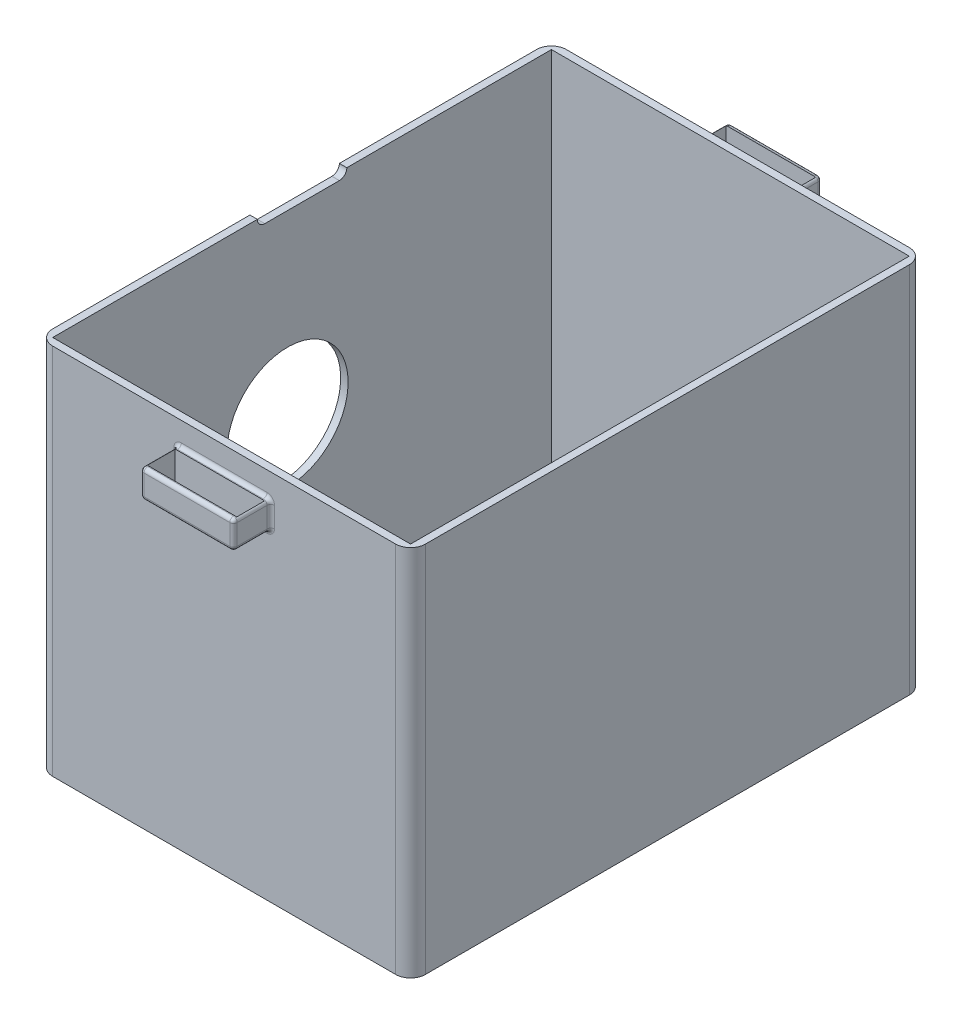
SolidWorks part; units mm, degrees
ref_plane "Front Plane" through (0, 0, 0) normal (0, 0, 1) x (1, 0, 0)
ref_plane "Top Plane" through (0, 0, 0) normal (0, 1, 0) x (1, 0, 0)
ref_plane "Right Plane" through (0, 0, 0) normal (1, 0, 0) x (0, 0, -1)
sketch "Sketch1" plane through (0, 0, 0) normal (0, 1, 0) x (1, 0, 0)
  line L1 (0, 0) -> (254, 0)
  line L2 (0, 0) -> (0, 350.012)
  line L3 (0, 350.012) -> (254, 350.012)
  line L4 (254, 0) -> (254, 350.012)
  dimension "D1" = 254
  dimension "D2" = 350.012
extrude "Boss-Extrude1" add sketch "Sketch1" along normal blind 254
sketch "Sketch10" plane through (0, 254, 0) normal (0, 1, 0) x (1, 0, 0)
  line L0 (254, 350.012) -> (0, 350.012) construction
  line L1 (5.08, 344.932) -> (248.92, 344.932)
  line L2 (5.08, 344.932) -> (5.08, 5.08)
  line L3 (5.08, 5.08) -> (248.92, 5.08)
  line L4 (248.92, 344.932) -> (248.92, 5.08)
  line L5 (0, 0) -> (254, 0) construction
  line L6 (0, 350.012) -> (0, 0) construction
  line L7 (254, 0) -> (254, 350.012) construction
  dimension "D1" = 5.08
  dimension "D2" = 5.08
  dimension "D3" = 5.08
  dimension "D4" = 5.08
extrude "Cut-Extrude13" cut sketch "Sketch10" against normal blind 253.238
sketch "Sketch11" plane through (0, 0, 0) normal (-1, 0, 0) x (0, 0, 1)
  line L0 (-350.012, 0) -> (0, 0) construction
  line L1 (0, 254) -> (0, 0) construction
  circle A0 centre (-165.1, 127) radius 41.275
  dimension "D1" = 82.55
  dimension "D2" = 127
  dimension "D3" = 165.1
extrude "Cut-Extrude14" cut sketch "Sketch11" against normal blind 241.3
fillet "Fillet2" radius 10.16 4 edges at (254, 127, -350.012) (0, 127, -350.012) (0, 127, 0) (254, 127, 0)
sketch "Sketch12" plane through (0, 0, 0) normal (-1, 0, 0) x (0, 0, 1)
  line L0 (-200.406, 254) -> (-149.606, 254) construction
  line L1 (-339.852, 254) -> (-10.16, 254) construction
  line L2 (-200.406, 259.08) -> (-149.606, 259.08)
  line L3 (-200.406, 248.92) -> (-149.606, 248.92)
  arc A0 (-200.406, 259.08) -> (-200.406, 248.92) centre (-200.406, 254) ccw
  arc A1 (-149.606, 248.92) -> (-149.606, 259.08) centre (-149.606, 254) ccw
  point P4 (-175.006, 254)
  dimension "D2" = 5.08
  dimension "D1" = 50.8
extrude "Cut-Extrude15" cut sketch "Sketch12" against normal blind 7.62
sketch "Sketch13" plane through (0, 0.762, 0) normal (0, 1, 0) x (1, 0, 0)
  circle A0 centre (50.8, 299.212) radius 2.54
  circle A1 centre (203.2, 299.212) radius 2.54
  circle A2 centre (203.2, 50.8) radius 2.54
  circle A3 centre (50.8, 50.8) radius 2.54
  arc A6 (243.84, 0) -> (254, 10.16) centre (243.84, 10.16) ccw construction
  arc A7 (254, 339.852) -> (243.84, 350.012) centre (243.84, 339.852) ccw construction
  arc A9 (10.16, 350.012) -> (0, 339.852) centre (10.16, 339.852) ccw construction
  dimension "D1" = 5.08
  dimension "D2" = 5.08
  dimension "D3" = 5.08
  dimension "D4" = 5.08
  dimension "D5" = 40.64
  dimension "D6" = 40.64
  dimension "D7" = 40.64
  dimension "D8" = 40.64
  dimension "D9" = 40.64
  dimension "D10" = 40.64
  dimension "D11" = 50.8
extrude "Cut-Extrude16" cut sketch "Sketch13" against normal through all
sketch "Sketch15" plane through (0, 0, 0) normal (0, 0, 1) x (1, 0, 0)
  line L0 (243.84, 0) -> (243.84, 254) construction
  line L1 (95.25, 238.125) -> (158.75, 238.125)
  line L2 (95.25, 238.125) -> (95.25, 219.075)
  line L3 (95.25, 219.075) -> (158.75, 219.075)
  line L4 (158.75, 238.125) -> (158.75, 219.075)
  line L5 (95.25, 238.125) -> (158.75, 219.075) construction
  line L6 (95.25, 219.075) -> (158.75, 238.125) construction
  point P0 (127, 228.6)
  dimension "D1" = 116.84
  dimension "D2" = 19.05
  dimension "D3" = 63.5
  dimension "D4" = 228.6
extrude "Boss-Extrude3" add sketch "Sketch15" along normal blind 25.4
sketch "Sketch16" plane through (0, 238.125, 0) normal (0, 1, 0) x (1, 0, 0)
  line L1 (96.52, -22.225) -> (157.48, -22.225)
  line L2 (96.52, -22.225) -> (96.52, -3.175)
  line L3 (96.52, -3.175) -> (157.48, -3.175)
  line L4 (157.48, -22.225) -> (157.48, -3.175)
  line L5 (96.52, -22.225) -> (157.48, -3.175) construction
  line L6 (96.52, -3.175) -> (157.48, -22.225) construction
  line L8 (10.16, 0) -> (243.84, 0) construction
  line L9 (95.25, -25.4) -> (95.25, 0) construction
  point P0 (127, -12.7)
  dimension "D1" = 19.05
  dimension "D2" = 60.96
  dimension "D3" = 12.7
  dimension "D4" = 1.27
extrude "Cut-Extrude17" cut sketch "Sketch16" against normal through all
fillet "Fillet3" radius 2.54 12 edges at (127, 238.125, 0) (95.25, 228.6, 0) (158.75, 228.6, 0) (127, 219.075, 0) (95.25, 219.075, 12.7) (158.75, 219.075, 12.7) (127, 219.075, 25.4) (95.25, 228.6, 25.4) (158.75, 228.6, 25.4) (95.25, 238.125, 12.7) (158.75, 238.125, 12.7) (127, 238.125, 25.4)
sketch "Sketch17" plane through (0, 0, -350.012) normal (0, 0, -1) x (-1, 0, 0)
  line L0 (-10.16, 0) -> (-10.16, 254) construction
  line L1 (-158.75, 241.3) -> (-95.25, 241.3)
  line L2 (-158.75, 241.3) -> (-158.75, 215.9)
  line L3 (-158.75, 215.9) -> (-95.25, 215.9)
  line L4 (-95.25, 241.3) -> (-95.25, 215.9)
  line L5 (-158.75, 241.3) -> (-95.25, 215.9) construction
  line L6 (-158.75, 215.9) -> (-95.25, 241.3) construction
  point P0 (-127, 228.6)
  dimension "D1" = 63.5
  dimension "D2" = 228.6
  dimension "D3" = 116.84
  dimension "D4" = 25.4
extrude "Boss-Extrude4" add sketch "Sketch17" along normal blind 25.4
sketch "Sketch18" plane through (0, 241.3, 0) normal (0, 1, 0) x (1, 0, 0)
  line L0 (158.75, 375.412) -> (158.75, 350.012) construction
  line L1 (96.52, 353.314) -> (157.48, 353.314)
  line L2 (96.52, 353.314) -> (96.52, 372.364)
  line L3 (96.52, 372.364) -> (157.48, 372.364)
  line L4 (157.48, 353.314) -> (157.48, 372.364)
  line L5 (96.52, 353.314) -> (157.48, 372.364) construction
  line L6 (96.52, 372.364) -> (157.48, 353.314) construction
  line L8 (95.25, 375.412) -> (158.75, 375.412) construction
  point P0 (127, 362.839)
  dimension "D1" = 60.96
  dimension "D2" = 1.27
  dimension "D3" = 19.05
  dimension "D4" = 3.048
extrude "Cut-Extrude18" cut sketch "Sketch18" against normal through all
fillet "Fillet4" radius 2.54 12 edges at (158.75, 228.6, -350.012) (127, 215.9, -350.012) (127, 241.3, -350.012) (158.75, 228.6, -375.412) (158.75, 215.9, -362.712) (127, 215.9, -375.412) (95.25, 215.9, -362.712) (95.25, 228.6, -375.412) (95.25, 228.6, -350.012) (95.25, 241.3, -362.712) (127, 241.3, -375.412) (158.75, 241.3, -362.712)
